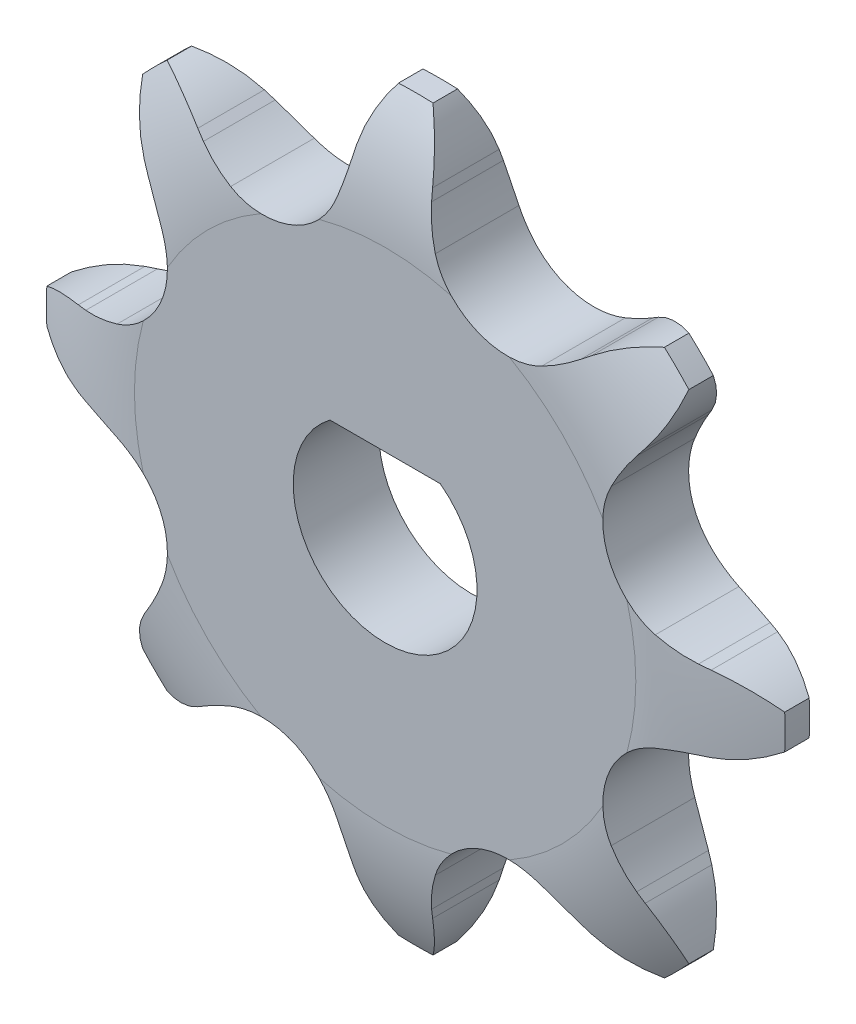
SolidWorks part; units mm, degrees
ref_plane "Front Plane" through (0, 0, 0) normal (0, 0, 1) x (1, 0, 0)
ref_plane "Top Plane" through (0, 0, 0) normal (0, 1, 0) x (1, 0, 0)
ref_plane "Right Plane" through (0, 0, 0) normal (1, 0, 0) x (0, 0, -1)
sketch "Sketch0" plane through (0, 0, 0) normal (0, 0, 1) x (1, 0, 0)
  line L0 (4, -9.6569) -> (0, 0) construction
  line L1 (0, 0) -> (9.6569, -4) construction
  line L2 (0, 0) -> (-4, -9.6569) construction
  line L3 (4, -9.6569) -> (9.6569, -4) construction
  line L4 (4, -9.6569) -> (-4, -9.6569) construction
  line L5 (6.4283, -8.1776) -> (6.1599, -7.9825)
  line L6 (4, -9.6569) -> (0, -11.3137) construction
  line L7 (1.2369, -10.3279) -> (1.2888, -10.0002)
  line L8 (0, -9.6569) -> (0, -12.0569) construction
  line L9 (5.0779, -7.3452) -> (2.3095, -13.2821) construction
  line L10 (0, 0) -> (0, -9.6569) construction
  line L11 (6.1599, -7.9825) -> (2.3095, -13.2821) construction
  line L12 (0, -12.0569) -> (0, -12.7231) construction
  line L13 (8.9497, -4.7071) -> (6.4283, -8.1776) construction
  circle A0 centre (0, 0) radius 12.0569 construction
  circle A1 centre (0, 0) radius 10.4525 construction
  arc A2 (-4.2727, -13.7535) -> (12.7464, -6.7039) centre (0, 0) ccw
  circle A3 centre (0, 0) radius 12.7231 construction
  circle A4 centre (4, -9.6569) radius 2.5 construction
  arc A7 (5.0779, -7.3452) -> (1.6032, -8.7845) centre (4, -9.6569) ccw
  circle A8 centre (4, -9.6569) radius 2.5506 construction
  arc A9 (6.4283, -8.1776) -> (12.7464, -6.7039) centre (8.9497, -4.7071) ccw
  arc A10 (6.1599, -7.9825) -> (5.0779, -7.3452) centre (2.3095, -13.2821) ccw
  arc A11 (1.2369, -10.3279) -> (-4.2727, -13.7535) centre (-3, -9.6569) cw
  arc A12 (1.2888, -10.0002) -> (1.6032, -8.7845) centre (7.7588, -11.0249) cw
sketch "Sketch1" plane through (0, 0, 0) normal (1, 0, 0) x (0, 0, -1)
  line L0 (1.4, 0) -> (-1.4, 0)
  line L1 (-1.4, 0) -> (-1.4, 8.1839)
  line L2 (-1.4, 10.4525) -> (0, 10.4525) construction
  line L3 (-0.4, 12.0569) -> (0.4, 12.0569)
  line L5 (1.4, 8.1839) -> (1.4, 0)
  line L7 (0, 12.0569) -> (0, 0) construction
  line L8 (-1.4, 8.1839) -> (1.4, 8.1839) construction
  line L9 (0, 12.0569) -> (0, -12.0569) construction
  line L10 (-1.4, 8.1839) -> (-1.4, 12.0569) construction
  line L11 (-1.4, 12.0569) -> (-0.4, 12.0569) construction
  line L12 (0.4, 12.0569) -> (1.4, 12.0569) construction
  line L13 (1.4, 12.0569) -> (1.4, 8.1839) construction
  line L14 (0, 0) -> (-6.4008, 0) construction
  line L15 (-1.4, 10.4525) -> (-1.4, 5.1525) construction
  line L22 (1.4, 0) -> (-10.6, 0) construction
  line L24 (-1.4, 0) -> (-1.4, 5.1525) construction
  arc A0 (-0.4, 12.0569) -> (-1.4, 8.1839) centre (6.6, 8.1839) ccw
  arc A1 (0.4, 12.0569) -> (1.4, 8.1839) centre (-6.6, 8.1839) cw
revolve "Revolve1" add sketch "Sketch1" angle 360 mid plane about L0
extrude "Cut-Extrude1" cut sketch "Sketch0" against normal through all and the other way through all
pattern_circular "CirPattern1" count 8 over 360 about axis through (0, 0, 0) along (0, 0, 1) of "Cut-Extrude1"
sketch "Sketch2" plane through (0, 0, 0) normal (0, 0, 1) x (1, 0, 0)
  circle A0 centre (0, 0) radius 3 construction
  circle A1 centre (0, 0) radius 6.5
  circle A2 centre (0, 0) radius 12.055 construction
  dimension "Bore" = 6
  dimension "Hub Dia." = 13
  dimension "OD" = 24.11
extrude "Boss-Extrude1" add sketch "Sketch2" along normal up to vertex (10.6 mm away) from surface at 1.4
sketch "Sketch3" plane through (0, 0, 0) normal (0, 0, 1) x (1, 0, 0)
  circle A0 centre (0, 0) radius 3 construction
  circle A1 centre (0, 0) radius 3
extrude "Cut-Extrude2" cut sketch "Sketch3" along normal through all and the other way through all
sketch "Sketch4" plane through (0, 0, 0) normal (1, 0, 0) x (0, 0, -1)
  line L0 (-10.6, 6.5) -> (-10.6, 6)
  line L1 (-1.4, 12.0569) -> (-3.5, 12.0569)
  line L2 (-1.4, 12.0569) -> (-1.4, 5.1525)
  line L3 (-1.4, 5.1525) -> (-3.5, 5.1525)
  line L4 (-3.5, 12.0569) -> (-3.5, 5.1525)
  line L9 (-10.6, 6) -> (-10.1, 6.5)
  line L10 (-10.1, 6.5) -> (-10.6, 6.5)
revolve "Cut-Revolve1" cut sketch "Sketch4" angle 360 mid plane about L22
sketch "Sketch5" plane through (0, 0, 0) normal (0, 0, 1) x (1, 0, 0)
  circle A0 centre (0, 0) radius 12.055 construction
  circle A1 centre (0, 0) radius 12.055
extrude "Cut-Extrude3" [suppressed] cut sketch "Sketch5" against normal through all and the other way through all flip side to cut
sketch "Sketch6" plane through (0, 0, 10.6) normal (0, 0, 1) x (1, 0, 0)
  circle A0 centre (0, 0) radius 6.5 construction
  circle A1 centre (0, 0) radius 6.5
extrude "Cut-Extrude4" cut sketch "Sketch6" against normal up to surface (9.2 mm away)
sketch "Sketch7" plane through (0, 0, -1.4) normal (0, 0, -1) x (-1, 0, 0)
  line L0 (-1.8, 2.4) -> (1.8, 2.4)
  circle A0 centre (0, 0) radius 3 construction
  arc A1 (1.8, 2.4) -> (-1.8, 2.4) centre (0, 0) ccw
  dimension "D1" = 3.6
extrude "Boss-Extrude2" add sketch "Sketch7" against normal up to surface (2.8 mm away)
equation "\"360/N@Sketch0\" = 360/\"Teeth@CirPattern1\""
equation "\"Ds@Sketch0\" = 1.005 * \"Dr@Sketch0\" + ( 0.003 * 25.4 ) "
equation "\"R@Sketch0\" = 1/2 * \"Ds@Sketch0\""
equation "\"A@Sketch0\" = 35 +  ( 60 / \"Teeth@CirPattern1\" ) "
equation "\"B@Sketch0\" = 18 -  ( 56 / \"Teeth@CirPattern1\" )"
equation "\"ac@Sketch0\" = 0.8 * \"Dr@Sketch0\""
equation "\"ab@Sketch0\" = 1.4 * \"Dr@Sketch0\""
equation "\"J@Sketch0\" = 0.3 * \"Pitch@Sketch0\""
equation "\"D3@Sketch4\" = \"t@Sketch1\" * 3 / 4"
